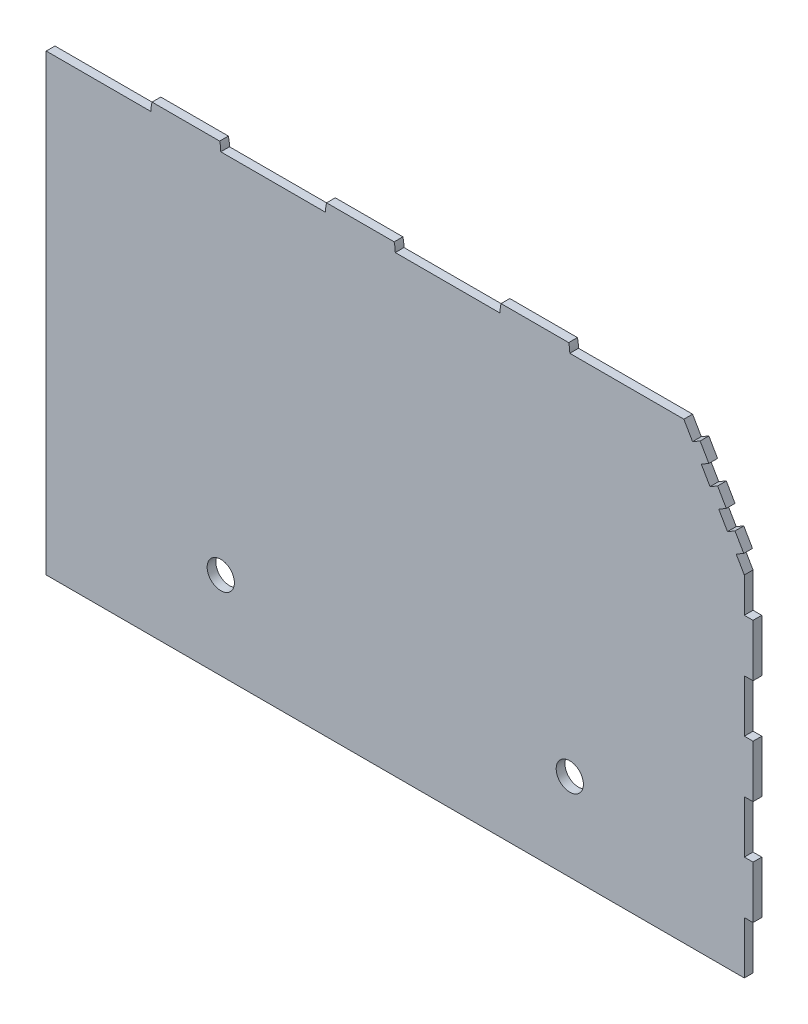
SolidWorks part; units mm, degrees
ref_plane "Front Plane" through (0, 0, 0) normal (0, 0, 1) x (1, 0, 0)
ref_plane "Top Plane" through (0, 0, 0) normal (0, 1, 0) x (1, 0, 0)
ref_plane "Right Plane" through (0, 0, 0) normal (1, 0, 0) x (0, 0, -1)
sketch "Sketch1" plane through (0, 0, 0) normal (0, 0, 1) x (1, 0, 0)
  line L0 (0, 0) -> (0, 165.1)
  line L1 (0, 165.1) -> (38.1, 165.1) construction
  line L2 (254, 165.1) -> (254, 114.3) construction
  line L3 (254, 0) -> (0, 0)
  line L4 (232.003, 165.1) -> (235.178, 159.6007)
  line L5 (0, 165.1) -> (38.1, 165.1)
  line L6 (254, 127) -> (254, 114.3)
  line L7 (0, 165.1) -> (38.1, 165.1) construction
  line L8 (38.1, 165.1) -> (38.1, 168.275) construction
  line L9 (38.1, 168.275) -> (63.5, 168.275) construction
  line L10 (63.5, 168.275) -> (63.5, 165.1) construction
  line L11 (63.5, 165.1) -> (101.6, 165.1) construction
  line L12 (101.6, 165.1) -> (101.6, 168.275) construction
  line L13 (101.6, 168.275) -> (127, 168.275) construction
  line L14 (127, 168.275) -> (127, 165.1) construction
  line L15 (127, 165.1) -> (165.1, 165.1) construction
  line L16 (165.1, 165.1) -> (165.1, 168.275) construction
  line L17 (165.1, 168.275) -> (190.5, 168.275) construction
  line L18 (190.5, 168.275) -> (190.5, 165.1) construction
  line L19 (38.5033, 168.275) -> (63.0967, 168.275)
  line L20 (102.0033, 168.275) -> (126.5967, 168.275)
  line L21 (165.5033, 168.275) -> (190.0967, 168.275)
  line L22 (232.003, 165.1) -> (235.178, 159.6007) construction
  line L23 (235.178, 159.6007) -> (237.9276, 161.1882)
  line L24 (237.9276, 161.1882) -> (241.1026, 155.689)
  line L25 (241.1026, 155.689) -> (238.353, 154.1015)
  line L26 (238.353, 154.1015) -> (241.528, 148.6022) construction
  line L27 (241.528, 148.6022) -> (244.2776, 150.1897)
  line L28 (244.2776, 150.1897) -> (247.4526, 144.6905)
  line L29 (247.4526, 144.6905) -> (244.703, 143.103)
  line L30 (244.703, 143.103) -> (247.878, 137.6037) construction
  line L31 (247.878, 137.6037) -> (250.6276, 139.1912)
  line L32 (250.6276, 139.1912) -> (253.8026, 133.6919)
  line L33 (253.8026, 133.6919) -> (251.053, 132.1044)
  line L34 (238.353, 154.1015) -> (241.528, 148.6022)
  line L35 (244.703, 143.103) -> (247.878, 137.6037)
  line L36 (251.053, 132.1044) -> (254, 127)
  line L37 (254, 0) -> (254, 19.05) construction
  line L38 (254, 19.05) -> (257.175, 19.05)
  line L39 (257.175, 19.05) -> (257.175, 38.1)
  line L40 (257.175, 38.1) -> (254, 38.1)
  line L41 (254, 38.1) -> (254, 57.15) construction
  line L42 (254, 57.15) -> (257.175, 57.15)
  line L43 (257.175, 57.15) -> (257.175, 76.2)
  line L44 (257.175, 76.2) -> (254, 76.2)
  line L45 (254, 76.2) -> (254, 95.25) construction
  line L46 (254, 95.25) -> (257.175, 95.25)
  line L47 (257.175, 95.25) -> (257.175, 114.3)
  line L48 (257.175, 114.3) -> (254, 114.3)
  line L49 (254, 95.25) -> (254, 76.2) construction
  line L50 (254, 95.25) -> (254, 76.2)
  line L51 (254, 57.15) -> (254, 38.1) construction
  line L52 (254, 57.15) -> (254, 38.1)
  line L53 (254, 19.05) -> (254, 0) construction
  line L54 (254, 19.05) -> (254, 0)
  line L55 (63.5, 165.1) -> (101.6, 165.1) construction
  line L56 (63.5, 165.1) -> (101.6, 165.1)
  line L57 (127, 165.1) -> (165.1, 165.1) construction
  line L58 (127, 165.1) -> (165.1, 165.1)
  line L59 (190.5, 165.1) -> (254, 165.1) construction
  line L60 (190.5, 165.1) -> (232.003, 165.1)
  line L61 (63.5, 0) -> (63.5, 109.6232) construction
  line L62 (0, 31.75) -> (221.5062, 31.75) construction
  line L63 (190.5, 0) -> (190.5, 71.906) construction
  arc A0 (63.5, 165.1) -> (63.0967, 168.275) centre (50.8, 165.1) ccw
  arc A1 (127, 165.1) -> (126.5967, 168.275) centre (114.3, 165.1) ccw
  arc A2 (190.5, 165.1) -> (190.0967, 168.275) centre (177.8, 165.1) ccw
  arc A3 (102.0033, 168.275) -> (101.6, 165.1) centre (114.3, 165.1) ccw
  arc A4 (165.5033, 168.275) -> (165.1, 165.1) centre (177.8, 165.1) ccw
  arc A5 (38.5033, 168.275) -> (38.1, 165.1) centre (50.8, 165.1) ccw
  circle A6 centre (63.5, 31.75) radius 4.953
  circle A7 centre (190.5, 31.75) radius 4.953
  dimension "D21" = 9.906
  dimension "D1" = 254
  dimension "D2" = 165.1
  dimension "D3" = 30
  dimension "D4" = 38.1
  dimension "D5" = 3.175
  dimension "D6" = 38.1
  dimension "D7" = 3.175
  dimension "D8" = 19.05
  dimension "D9" = 25.4
  dimension "D10" = 19.05
  dimension "D11" = 63.5
  dimension "D12" = 3.175
  dimension "D13" = 6.35
  dimension "D14" = 6.35
  dimension "D15" = 6.35
  dimension "D16" = 6.35
  dimension "D17" = 6.35
  dimension "D18" = 6.35
  dimension "D19" = 127
  dimension "D20" = 31.75
extrude "Boss-Extrude1" add sketch "Sketch1" along normal blind 3.175
